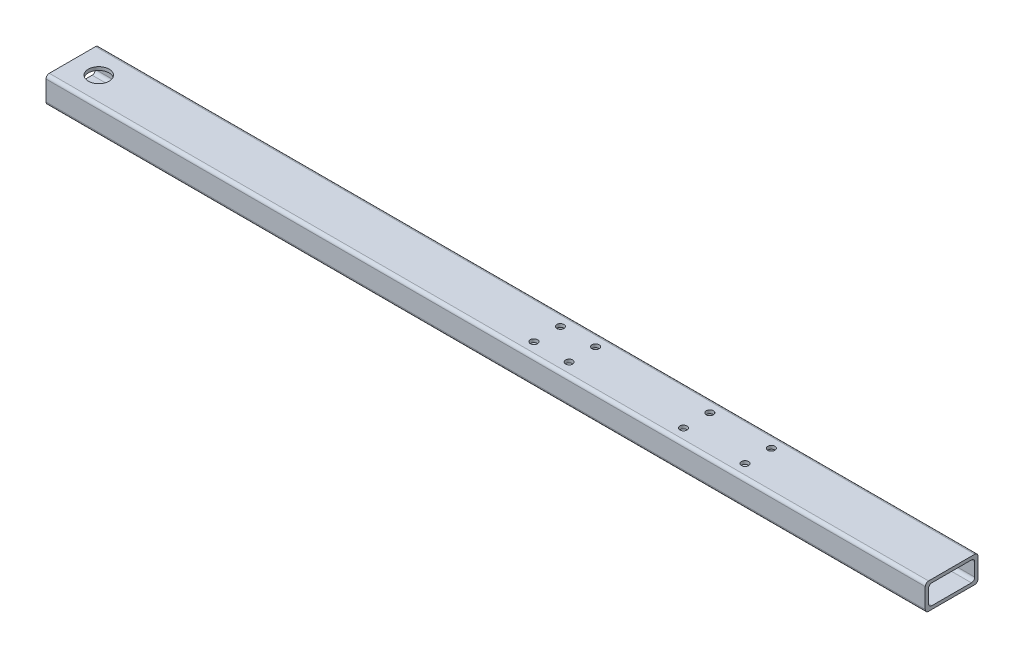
SolidWorks part; units mm, degrees
ref_plane "Front Plane" through (0, 0, 0) normal (0, 0, 1) x (1, 0, 0)
ref_plane "Top Plane" through (0, 0, 0) normal (0, 1, 0) x (1, 0, 0)
ref_plane "Right Plane" through (0, 0, 0) normal (1, 0, 0) x (0, 0, -1)
sketch "Sketch1" plane through (0, 0, 0) normal (0, 1, 0) x (1, 0, 0)
  line L1 (0, 0) -> (-2540, 0)
  line L2 (0, 0) -> (0, -152.4)
  line L3 (0, -152.4) -> (-2540, -152.4)
  line L4 (-2540, 0) -> (-2540, -152.4)
  dimension "D1" = 2540
  dimension "D2" = 152.4
extrude "Extrude1" add sketch "Sketch1" along normal blind 76.2
sketch "Sketch3" plane through (0, 0, 0) normal (1, 0, 0) x (0, 0, -1)
  line L0 (-152.4, 0) -> (0, 0) construction
  line L1 (-9.525, 66.675) -> (-142.875, 66.675)
  line L2 (-9.525, 66.675) -> (-9.525, 9.525)
  line L3 (-9.525, 9.525) -> (-142.875, 9.525)
  line L4 (-142.875, 66.675) -> (-142.875, 9.525)
  dimension "D1" = 9.525
  dimension "D2" = 142.875
  dimension "D3" = 9.525
  dimension "D4" = 66.675
extrude "Cut-Extrude1" cut sketch "Sketch3" against normal blind 2540
fillet "Fillet1" radius 9.525 8 edges at (-1270, 9.525, 142.875) (-1270, 66.675, 9.525) (-1270, 66.675, 142.875) (-1270, 0, 152.4) (-1270, 0, 0) (-1270, 9.525, 9.525) (-1270, 76.2, 0) (-1270, 76.2, 152.4)
sketch "Sketch4" plane through (0, 76.2, 0) normal (0, 1, 0) x (1, 0, 0)
  line L0 (0, -142.875) -> (0, -9.525) construction
  line L1 (-2540, -142.875) -> (0, -142.875) construction
  circle A0 centre (-2463.8, -76.2) radius 30.1625
  dimension "D1" = 60.325
  dimension "D2" = 2463.8
  dimension "D3" = 66.675
extrude "Cut-Extrude2" cut sketch "Sketch4" against normal blind 76.2
sketch "Sketch5" plane through (0, 76.2, 0) normal (0, 1, 0) x (1, 0, 0)
  line L0 (0, -142.875) -> (0, -9.525) construction
  line L1 (-2540, -142.875) -> (0, -142.875) construction
  circle A0 centre (-1066.8, -38.1) radius 10.3188
  dimension "D1" = 20.6375
  dimension "D2" = 1066.8
  dimension "D3" = 104.775
sketch "Sketch6" plane through (0, 76.2, 0) normal (0, 1, 0) x (1, 0, 0)
  line L0 (0, -142.875) -> (0, -9.525) construction
  line L1 (-2540, -142.875) -> (0, -142.875) construction
  circle A0 centre (-1168.4, -38.1) radius 10.3188
  dimension "D1" = 20.6375
  dimension "D2" = 1168.4
  dimension "D3" = 104.775
sketch "Sketch7" plane through (0, 76.2, 0) normal (0, 1, 0) x (1, 0, 0)
  line L0 (0, -142.875) -> (0, -9.525) construction
  line L1 (-2540, -142.875) -> (0, -142.875) construction
  circle A0 centre (-736.6, -38.1) radius 10.3188
  dimension "D1" = 20.6375
  dimension "D2" = 736.6
  dimension "D3" = 104.775
sketch "Sketch8" plane through (0, 76.2, 0) normal (0, 1, 0) x (1, 0, 0)
  line L0 (0, -142.875) -> (0, -9.525) construction
  line L1 (-2540, -142.875) -> (0, -142.875) construction
  circle A0 centre (-558.8, -38.1) radius 10.3188
  dimension "D1" = 20.6375
  dimension "D2" = 558.8
  dimension "D3" = 104.775
extrude "Cut-Extrude8" cut sketch "Sketch5" against normal blind 76.2
extrude "Cut-Extrude9" cut sketch "Sketch6" against normal blind 76.2
extrude "Cut-Extrude10" cut sketch "Sketch7" against normal blind 76.2
extrude "Cut-Extrude11" cut sketch "Sketch8" against normal blind 76.2
ref_plane "Plane1" through (0, 0, 76.2) normal (0, 0, 1) x (1, 0, 0)
mirror "Mirror1" about plane through (0, 0, 76.2) normal (0, 0, 1) of "Cut-Extrude11", "Cut-Extrude10", "Cut-Extrude9", "Cut-Extrude8"
